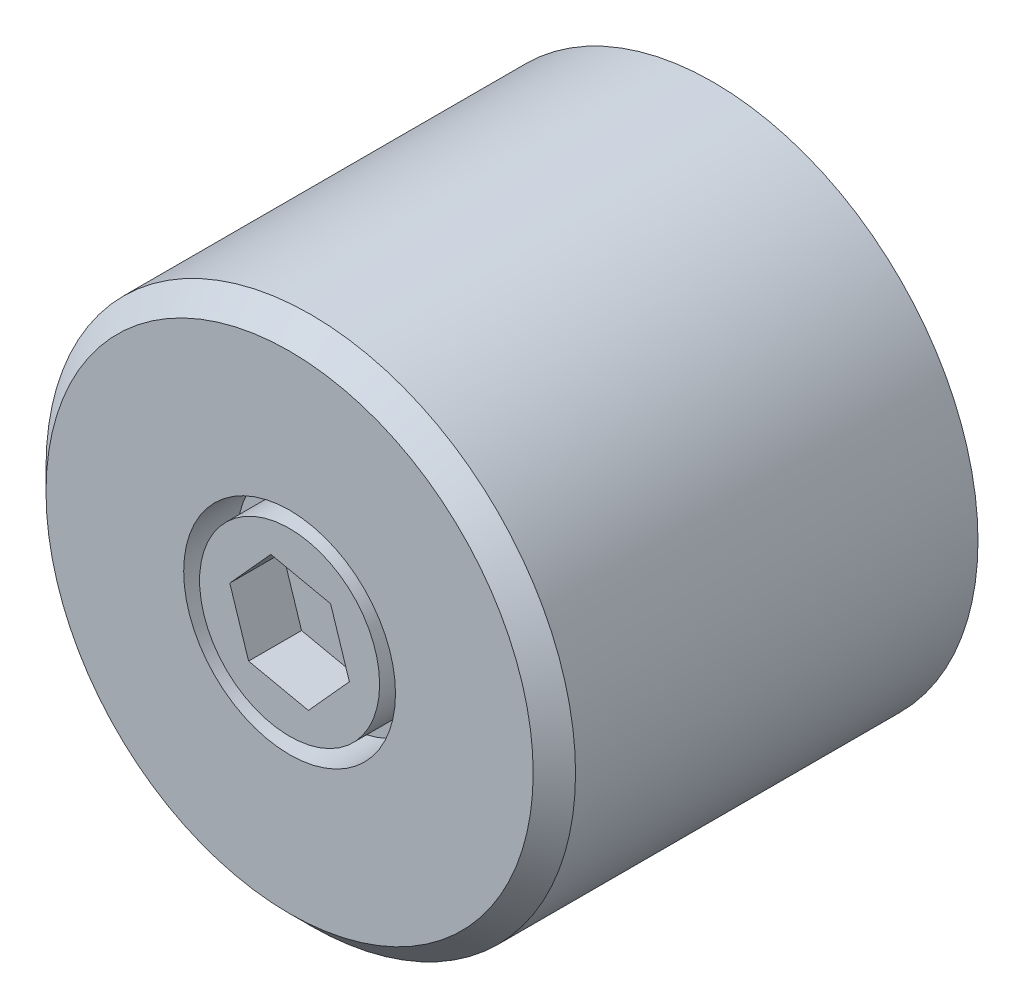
SolidWorks part; units mm, degrees
ref_plane "Přední rovina" through (0, 0, 0) normal (0, 0, 1) x (1, 0, 0)
ref_plane "Horní rovina" through (0, 0, 0) normal (0, 1, 0) x (1, 0, 0)
ref_plane "Pravá rovina" through (0, 0, 0) normal (1, 0, 0) x (0, 0, -1)
sketch "Skica1" plane through (0, 0, 0) normal (0, 0, 1) x (1, 0, 0)
  circle A0 centre (0, 0) radius 25
  dimension "D1" = 50
extrude "Vysunout1" add sketch "Skica1" along normal blind 40
sketch "Skica2" plane through (0, 0, 40) normal (0, 0, 1) x (1, 0, 0)
  line L1 (3.8723, 4.2823) -> (-1.7725, 5.4947)
  line L2 (-1.7725, 5.4947) -> (-5.6448, 1.2124)
  line L3 (-5.6448, 1.2124) -> (-3.8723, -4.2823)
  line L4 (-3.8723, -4.2823) -> (1.7725, -5.4947)
  line L5 (1.7725, -5.4947) -> (5.6448, -1.2124)
  line L6 (5.6448, -1.2124) -> (3.8723, 4.2823)
  circle A0 centre (0, 0) radius 10
  circle A1 centre (0, 0) radius 8.5
  circle A2 centre (0, 0) radius 5 construction
  dimension "D1" = 20
  dimension "D2" = 17
  dimension "D3" = 10
extrude "Odebrat vysunutím1" cut sketch "Skica2" against normal blind 5 contours A0 | A1 | L1 L2 L3 L4 L5 L6
chamfer "Zkosit1" distance 2 angle 45 1 edges at (25, 0, 40)
